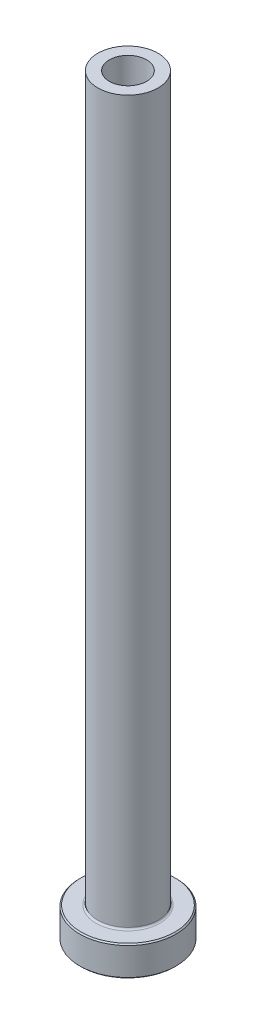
SolidWorks part; units mm, degrees
ref_plane "Front Plane" through (0, 0, 0) normal (0, 0, 1) x (1, 0, 0)
ref_plane "Top Plane" through (0, 0, 0) normal (0, 1, 0) x (1, 0, 0)
ref_plane "Right Plane" through (0, 0, 0) normal (1, 0, 0) x (0, 0, -1)
sketch "Sketch1" plane through (0, 0, 0) normal (0, 0, 1) x (1, 0, 0)
  line L0 (-3.1, 125) -> (-5, 125)
  line L1 (-5, 125) -> (-5, 5)
  line L2 (-5, 5) -> (-8, 5)
  line L3 (-8, 5) -> (-8, 0)
  line L4 (8.8, 0) -> (-8.8, 0) construction
  line L5 (-8, 0) -> (-3.35, 0)
  line L6 (-3.1, 80) -> (-3.1, 125)
  line L7 (0, 92.1877) -> (0, -15.5353) construction
  line L8 (0, -8.8) -> (0, 8.8) construction
  line L9 (-3.1, 80) -> (-3.35, 68)
  line L10 (-3.35, 68) -> (-3.35, 0)
  dimension "D1" = 0.25
  dimension "ID" = 6.2
  dimension "OD" = 10
  dimension "L" = 125
  dimension "H" = 16
  dimension "T" = 5
  dimension "N" = 45
  dimension "D2" = 12
revolve "Revolve1" add sketch "Sketch1" angle 360 about L7
fillet "Fillet1" radius 0.3 1 edges at (0, 5, 5)
chamfer "Chamfer1" distance 0.2 angle 45 2 edges at (0, 5, 8) (0, 0, 8)
chamfer "Chamfer3" distance 0.5 angle 45 1 edges at (0, 0, 3.35)
